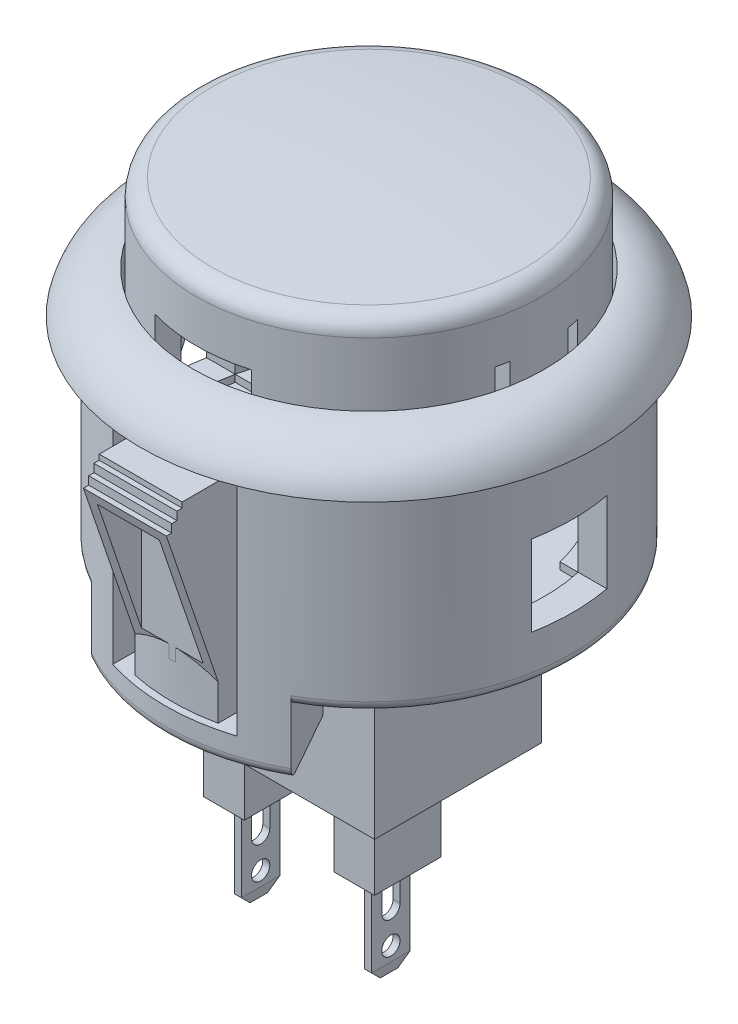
SolidWorks part; units mm, degrees
ref_plane "Front Plane" through (0, 0, 0) normal (0, 0, 1) x (1, 0, 0)
ref_plane "Top Plane" through (0, 0, 0) normal (0, 1, 0) x (1, 0, 0)
ref_plane "Right Plane" through (0, 0, 0) normal (1, 0, 0) x (0, 0, -1)
imported_body "microswitch-1-solid1"
imported_body "top_cap-1-solid1"
imported_body "base__-1-solid1"
scale "Scale2" bodies to scale 101 103 102 scale about centroid uniform scaling yes scale factor 0.814664
